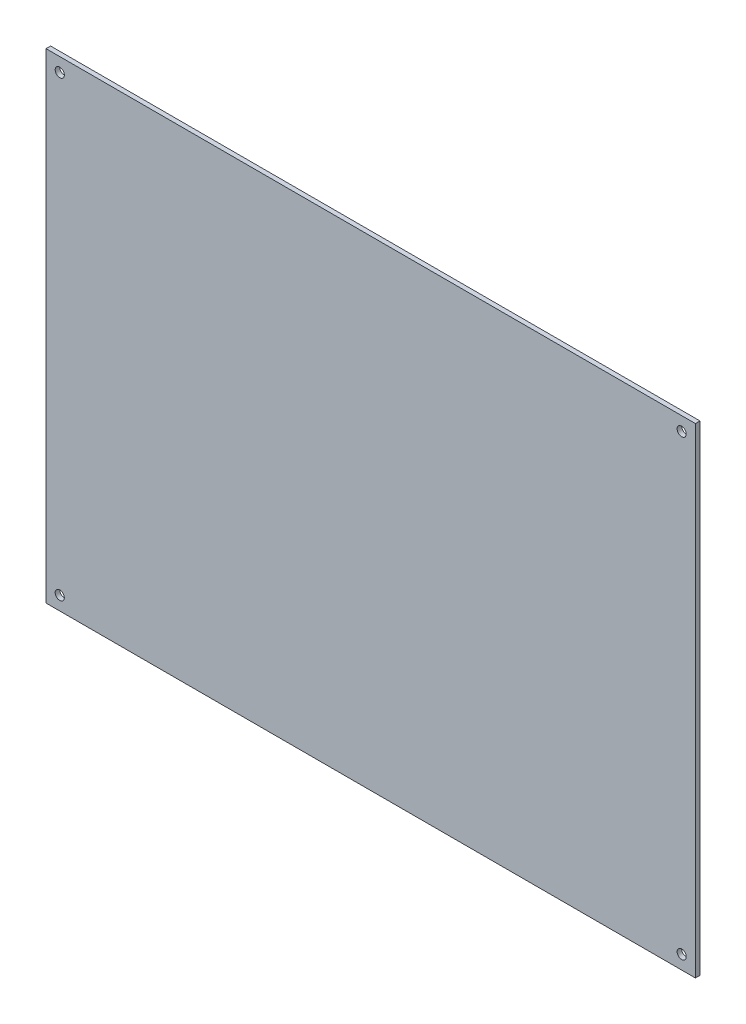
SolidWorks part; units mm, degrees
ref_plane "Front Plane" through (0, 0, 0) normal (0, 0, 1) x (1, 0, 0)
ref_plane "Top Plane" through (0, 0, 0) normal (0, 1, 0) x (1, 0, 0)
ref_plane "Right Plane" through (0, 0, 0) normal (1, 0, 0) x (0, 0, -1)
sketch "Sketch1" plane through (0, 0, 0) normal (0, 0, 1) x (1, 0, 0)
  line L1 (-182.2354, 170.9541) -> (178.4446, 170.9541)
  line L2 (-182.2354, 170.9541) -> (-182.2354, -95.7459)
  line L3 (-182.2354, -95.7459) -> (178.4446, -95.7459)
  line L4 (178.4446, 170.9541) -> (178.4446, -95.7459)
  circle A0 centre (-174.6154, 163.3341) radius 2.54
  circle A1 centre (-174.6154, -88.1259) radius 2.54
  circle A2 centre (170.8246, -88.1259) radius 2.54
  circle A3 centre (170.8246, 163.3341) radius 2.54
  dimension "D7" = 5.08
  dimension "D8" = 5.08
  dimension "D9" = 5.08
  dimension "D10" = 5.08
  dimension "D5" = 7.62
  dimension "D12" = 7.62
  dimension "D3" = 7.62
  dimension "D13" = 7.62
  dimension "D14" = 7.62
  dimension "D1" = 266.7
  dimension "D2" = 360.68
  dimension "D4" = 7.62
  dimension "D6" = 7.62
  dimension "D11" = 7.62
extrude "Boss-Extrude1" add sketch "Sketch1" along normal blind 2.54
